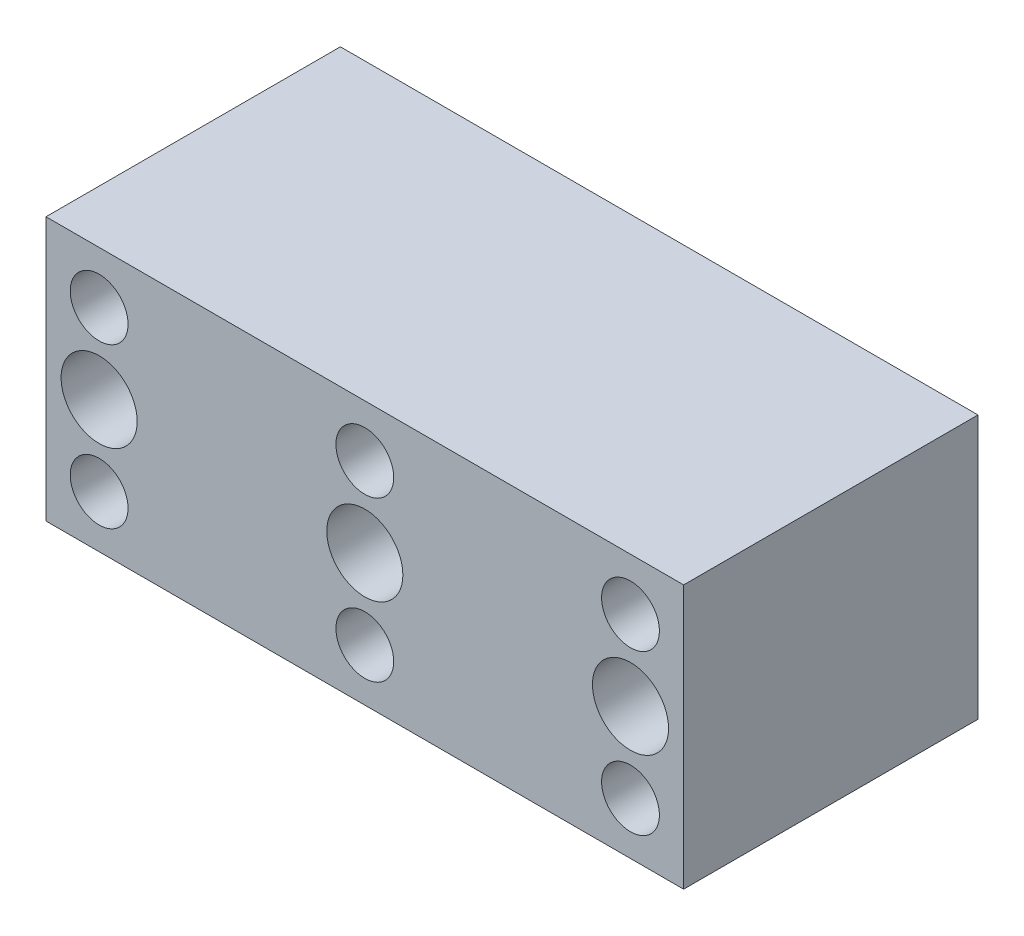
SolidWorks part; units mm, degrees
ref_plane "Front" through (0, 0, 0) normal (0, 0, 1) x (1, 0, 0)
ref_plane "Top" through (0, 0, 0) normal (0, 1, 0) x (1, 0, 0)
ref_plane "Right" through (0, 0, 0) normal (1, 0, 0) x (0, 0, -1)
sketch "Sketch1" plane through (0, 0, 0) normal (0, 0, 1) x (1, 0, 0)
  line L1 (0, 0) -> (76.2, 0)
  line L2 (0, 0) -> (0, 31.496)
  line L3 (0, 31.496) -> (76.2, 31.496)
  line L4 (76.2, 0) -> (76.2, 31.496)
  dimension "D1" = 76.2
  dimension "D2" = 31.496
extrude "Boss-Extrude1" add sketch "Sketch1" against normal blind 35.179
sketch "Sketch2" plane through (0, 0, 0) normal (0, 0, 1) x (1, 0, 0)
  line L0 (0, 31.496) -> (0, 0) construction
  line L1 (76.2, 31.496) -> (0, 31.496) construction
  circle A0 centre (6.35, 25.273) radius 2.1082
  circle A1 centre (38.1, 25.273) radius 2.1082
  circle A2 centre (69.85, 25.273) radius 2.1082
  circle A3 centre (69.85, 6.223) radius 2.1082
  circle A4 centre (38.1, 6.223) radius 2.1082
  circle A5 centre (6.35, 6.223) radius 2.1082
  dimension "D1" = 4.2164
  dimension "D2" = 4.2164
  dimension "D3" = 4.2164
  dimension "D4" = 4.2164
  dimension "D5" = 4.2164
  dimension "D6" = 4.2164
  dimension "D9" = 31.75
  dimension "D10" = 31.75
  dimension "D11" = 31.75
  dimension "D12" = 31.75
  dimension "D13" = 6.223
  dimension "D14" = 6.223
  dimension "D15" = 6.223
  dimension "D16" = 19.05
  dimension "D17" = 19.05
  dimension "D18" = 19.05
  dimension "D7" = 38.1
  dimension "D8" = 38.1
extrude "Cut-Extrude1" cut sketch "Sketch2" against normal through all contours A0
sketch "Sketch3" plane through (0, 0, 0) normal (0, 0, 1) x (1, 0, 0)
  circle A0 centre (6.35, 25.273) radius 3.4544
  circle A1 centre (38.1, 25.273) radius 3.4544
  circle A2 centre (69.85, 25.273) radius 3.4544
  circle A3 centre (69.85, 6.223) radius 3.4544
  circle A4 centre (38.1, 6.223) radius 3.4544
  circle A5 centre (6.35, 6.223) radius 3.4544
  dimension "D1" = 6.9088
  dimension "D2" = 6.9088
  dimension "D3" = 6.9088
  dimension "D4" = 6.9088
  dimension "D5" = 6.9088
  dimension "D6" = 6.9088
extrude "Cut-Extrude2" cut sketch "Sketch3" against normal blind 5.08
hole_wizard "1/8-27 NPSM Tapped Hole1" positions "Sketch4" profile "Sketch5" tap size "1/8-27 NPSM" standard "ANSI Inch"
sketch "Sketch4" plane through (0, 0, 0) normal (0, 0, 1) x (1, 0, 0)
  line L0 (76.2, 31.496) -> (0, 31.496) construction
  line L1 (76.2, 0) -> (76.2, 31.496) construction
  point P0 (6.35, 15.748)
  point P2 (38.1, 15.748)
  point P4 (69.85, 15.748)
  dimension "D1" = 15.748
  dimension "D2" = 15.748
  dimension "D3" = 15.748
  dimension "D4" = 38.1
  dimension "D5" = 31.75
  dimension "D6" = 31.75
sketch "Sketch5" plane through (6.35, 15.748, 0) normal (1, 0, 0) x (0, -1, 0)
  line L0 (0, 0) -> (0, 35.179)
  line L1 (0, 35.179) -> (4.5466, 35.179)
  line L2 (4.5466, 35.179) -> (4.5466, 0)
  line L5 (4.5466, 0) -> (0, 0)
  line L11 (0, -6.35) -> (0, 107.95) construction
  dimension "Thru Tap Drill Dia." = 9.0932
  dimension "Thru Tap Drill Depth" = 35.179
